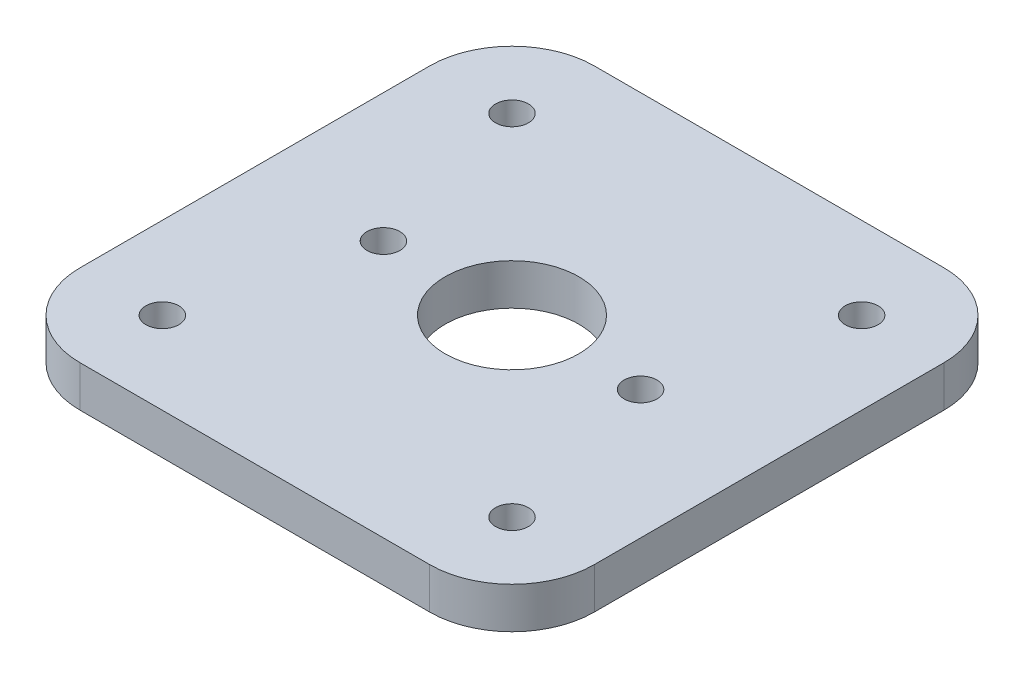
SolidWorks part; units mm, degrees
ref_plane "Ebene vorne" through (0, 0, 0) normal (0, 0, 1) x (1, 0, 0)
ref_plane "Ebene oben" through (0, 0, 0) normal (0, 1, 0) x (1, 0, 0)
ref_plane "Ebene rechts" through (0, 0, 0) normal (1, 0, 0) x (0, 0, -1)
sketch "Skizze1" plane through (0, 0, 0) normal (0, 1, 0) x (1, 0, 0)
  line L0 (0, 45.2149) -> (0, -41.3114) construction
  line L1 (-56.7626, 0) -> (54.4856, 0) construction
  line L3 (-17, 25) -> (17, 25)
  line L4 (-25, 17) -> (-25, -17)
  line L5 (-17, -25) -> (17, -25)
  line L6 (25, 17) -> (25, -17)
  circle A0 centre (0, 0) radius 6.5
  circle A1 centre (-12.5, 0) radius 1.6
  circle A2 centre (12.5, 0) radius 1.6
  arc A3 (-25, -17) -> (-17, -25) centre (-17, -17) ccw
  arc A4 (17, -25) -> (25, -17) centre (17, -17) ccw
  arc A5 (17, 25) -> (25, 17) centre (17, 17) cw
  arc A6 (-17, 25) -> (-25, 17) centre (-17, 17) ccw
  circle A7 centre (-17, 17) radius 1.6
  circle A8 centre (17, 17) radius 1.6
  circle A9 centre (-17, -17) radius 1.6
  circle A10 centre (17, -17) radius 1.6
  dimension "D3" = 13
  dimension "D4" = 3.2
  dimension "D5" = 25
  dimension "D1" = 8
  dimension "D7" = 3.2
  dimension "D2" = 50
  dimension "D6" = 50
  dimension "D8" = 34
extrude "Aufsatz-Linear austragen1" add sketch "Skizze1" along normal blind 4
